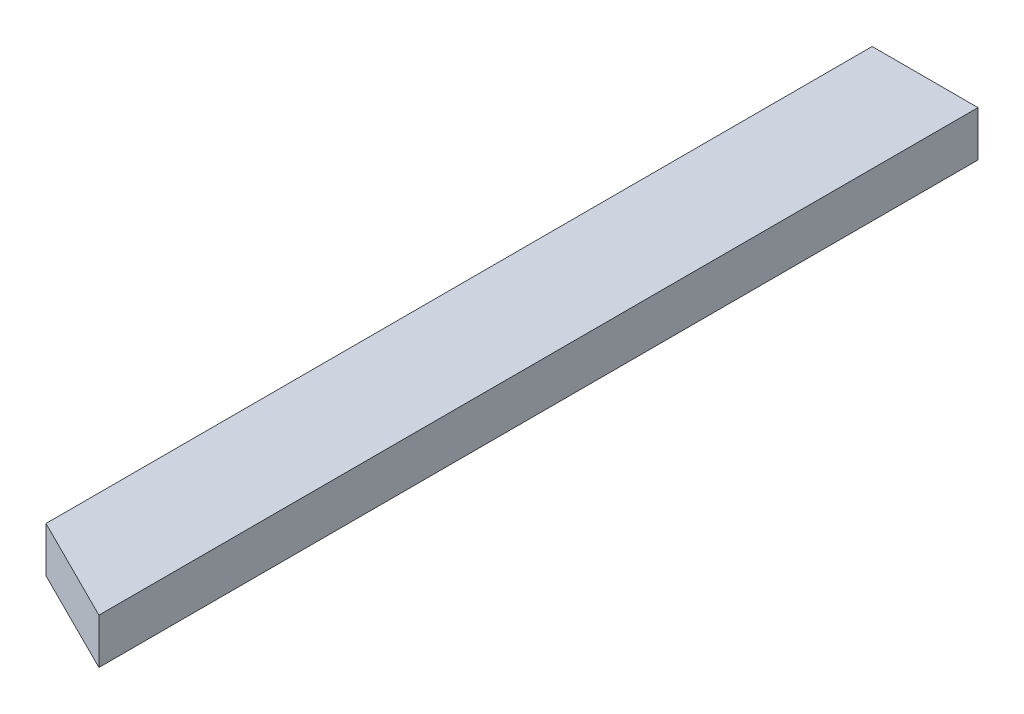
SolidWorks part; units mm, degrees
ref_plane "Front Plane" through (0, 0, 0) normal (0, 0, 1) x (1, 0, 0)
ref_plane "Top Plane" through (0, 0, 0) normal (0, 1, 0) x (1, 0, 0)
ref_plane "Right Plane" through (0, 0, 0) normal (1, 0, 0) x (0, 0, -1)
sketch "Sketch1" plane through (0, 0, 0) normal (0, 1, 0) x (1, 0, 0)
  line L0 (0, 0) -> (0, -738.378)
  line L1 (0, -738.378) -> (-88.9, -693.9184)
  line L2 (-88.9, -693.9184) -> (-88.9, 0)
  line L3 (-88.9, 0) -> (0, 0)
  line L4 (0, -738.378) -> (-176.9307, -738.378) construction
  dimension "D1" = 738.378
  dimension "D3" = 26.57
  dimension "D4" = 88.9
extrude "Boss-Extrude1" add sketch "Sketch1" along normal blind 38.1
